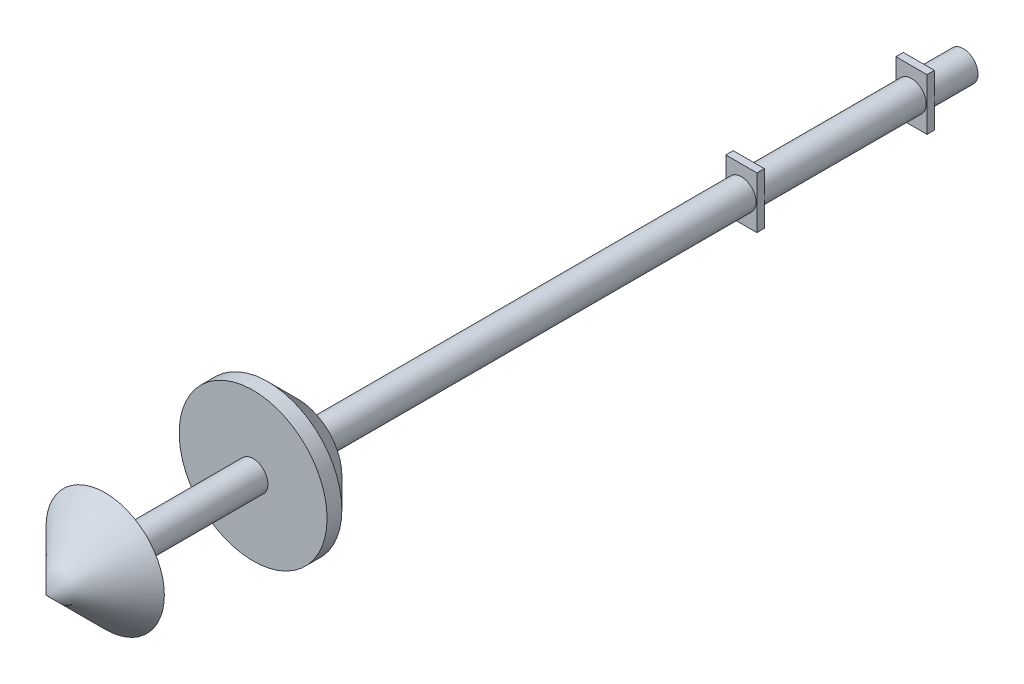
SolidWorks part; units mm, degrees
ref_plane "Plan de face" through (0, 0, 0) normal (0, 0, 1) x (1, 0, 0)
ref_plane "Plan de dessus" through (0, 0, 0) normal (0, 1, 0) x (1, 0, 0)
ref_plane "Plan de droite" through (0, 0, 0) normal (1, 0, 0) x (0, 0, -1)
sketch "Esquisse1" plane through (0, 0, 0) normal (0, 0, 1) x (1, 0, 0)
  circle A0 centre (0, 0) radius 10
  dimension "D1" = 20
extrude "Extrusion1" add sketch "Esquisse1" along normal blind 300
sketch "Esquisse2" plane through (0, 0, 0) normal (0, 0, -1) x (-1, 0, 0)
  line L1 (-10.5, 17.5) -> (10.5, 17.5)
  line L2 (-10.5, 17.5) -> (-10.5, -17.5)
  line L3 (-10.5, -17.5) -> (10.5, -17.5)
  line L4 (10.5, 17.5) -> (10.5, -17.5)
  dimension "D1" = 21
  dimension "D2" = 10.5
  dimension "D3" = 35
  dimension "D4" = 17.5
extrude "Extrusion2" add sketch "Esquisse2" along normal blind 5
sketch "Esquisse3" plane through (0, 0, -5) normal (0, 0, -1) x (-1, 0, 0)
  circle A0 centre (0, 0) radius 10 construction
  circle A1 centre (0, 0) radius 10
extrude "Extrusion3" add sketch "Esquisse3" along normal blind 110
sketch "Esquisse4" plane through (0, 0, -115) normal (0, 0, -1) x (-1, 0, 0)
  line L4 (-10.5, 17.5) -> (-10.5, -17.5)
  line L5 (-10.5, -17.5) -> (10.5, -17.5)
  line L6 (10.5, -17.5) -> (10.5, 17.5)
  line L7 (10.5, 17.5) -> (-10.5, 17.5)
  line L8 (-10.5, 17.5) -> (-10.5, -17.5)
  line L9 (-10.5, -17.5) -> (10.5, -17.5)
  line L10 (10.5, -17.5) -> (10.5, 17.5)
  line L11 (10.5, 17.5) -> (-10.5, 17.5)
  dimension "D1" = 0
extrude "Extrusion4" add sketch "Esquisse4" along normal blind 5
sketch "Esquisse5" plane through (0, 0, -120) normal (0, 0, -1) x (-1, 0, 0)
  circle A0 centre (0, 0) radius 10 construction
  circle A1 centre (0, 0) radius 10
extrude "Extrusion5" add sketch "Esquisse5" along normal blind 30
sketch "Esquisse7" plane through (0, 0, 300) normal (0, 0, 1) x (1, 0, 0)
  circle A0 centre (0, 0) radius 50
  dimension "D1" = 100
extrude "Extrusion7" add sketch "Esquisse7" along normal blind 30
chamfer "Chanfrein1" distance 20 angle 45 1 edges at (50, 0, 300)
sketch "Esquisse8" plane through (0, 0, 0) normal (1, 0, 0) x (0, 0, -1)
  line L0 (-300, 0) -> (-220, 0) construction
  line L1 (-300, -10) -> (-300, 10) construction
  dimension "D1" = 80
sketch "Esquisse9" plane through (0, 0, 330) normal (0, 0, 1) x (1, 0, 0)
  circle A0 centre (0, 0) radius 10 construction
  circle A1 centre (0, 0) radius 10
extrude "Extrusion8" add sketch "Esquisse9" along normal blind 100
sketch "Esquisse10" plane through (0, 0, 0) normal (1, 0, 0) x (0, 0, -1)
  line L0 (-430, 0) -> (-430, 40)
  line L1 (-430, 10) -> (-430, -10) construction
  line L2 (-430, 40) -> (-470, 0)
  line L3 (-470, 0) -> (-430, 0)
  dimension "D1" = 40
  dimension "D2" = 40
revolve "Révolution1" add sketch "Esquisse10" angle 360 about L3
sketch "Esquisse11" plane through (0, 0, 0) normal (1, 0, 0) x (0, 0, -1)
  point P0 (-470, 0)
